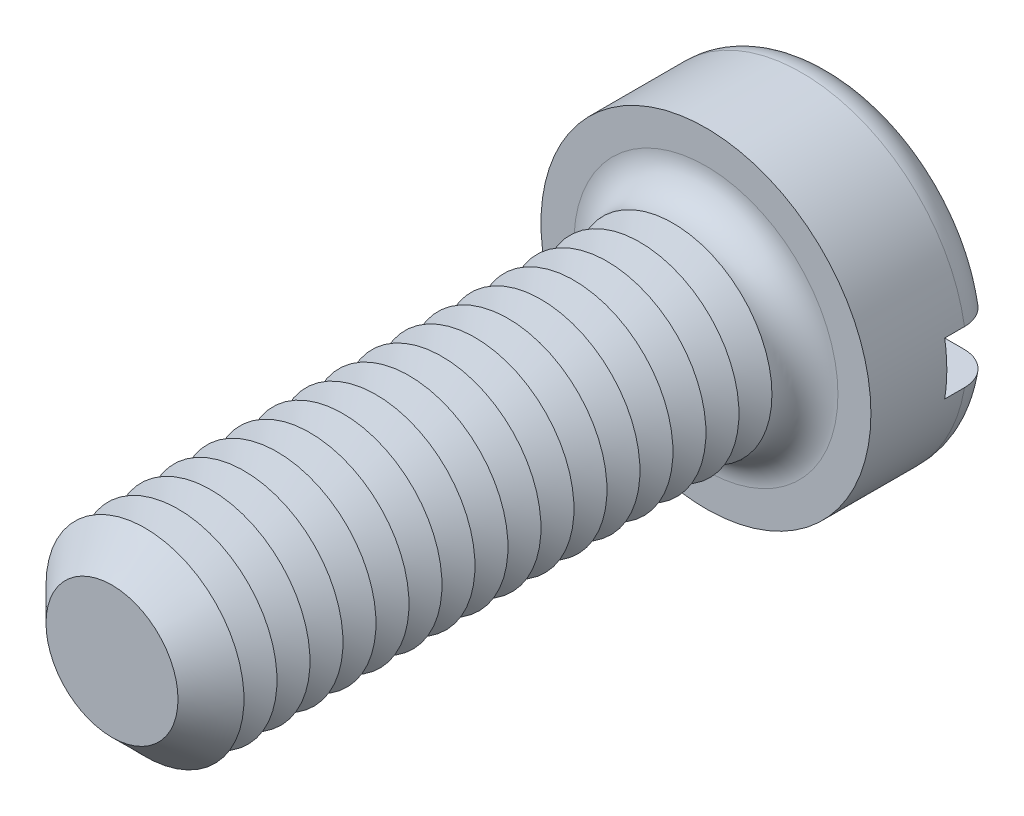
SolidWorks part; units mm, degrees
ref_plane "Front Plane" through (0, 0, 0) normal (0, 0, 1) x (1, 0, 0)
ref_plane "Top Plane" through (0, 0, 0) normal (0, 1, 0) x (1, 0, 0)
ref_plane "Right Plane" through (0, 0, 0) normal (1, 0, 0) x (0, 0, -1)
sketch "Sketch3" plane through (0, 0, 0) normal (0, 0, 1) x (1, 0, 0)
  circle A0 centre (0, 0) radius 5
  dimension "D1" = 10
extrude "Boss-Extrude2" add sketch "Sketch3" against normal blind 3.9
sketch "Sketch4" plane through (0, 0, 0) normal (0, 0, 1) x (1, 0, 0)
  circle A0 centre (0, 0) radius 3
  dimension "D1" = 6
extrude "Boss-Extrude3" add sketch "Sketch4" along normal blind 18
fillet "Fillet1" radius 1 2 edges at (5, 0, -3.9) (3, 0, 0)
chamfer "Chamfer1" distance 1 angle 45 1 edges at (3, 0, 18)
sketch "Sketch5" plane through (0, 0, 0) normal (1, 0, 0) x (0, 0, -1)
  line L0 (1.6944, 0) -> (-7.6738, 0) construction
sketch "Sketch6" plane through (0, 0, 0) normal (1, 0, 0) x (0, 0, -1)
  line L0 (-1, 3) -> (-1.5, 2.134)
  line L1 (-1.5, 2.134) -> (-2, 3)
  line L2 (-1, 3) -> (-17, 3) construction
  line L3 (-2, 3) -> (-1, 3)
  dimension "D1" = 1
revolve "Cut-Revolve1" cut sketch "Sketch6" angle 360 about L0
pattern_linear "LPattern1" count 16 spacing 1 along (0, 0, 1) of "Cut-Revolve1"
sketch "Sketch8" plane through (0, 0, -3.9) normal (0, 0, -1) x (-1, 0, 0)
  line L1 (5, -0.8) -> (-5, -0.8)
  line L2 (5, -0.8) -> (5, 0.8)
  line L3 (5, 0.8) -> (-5, 0.8)
  line L4 (-5, -0.8) -> (-5, 0.8)
  line L5 (5, -0.8) -> (-5, 0.8) construction
  line L6 (5, 0.8) -> (-5, -0.8) construction
  point P0 (0, 0)
  dimension "D1" = 10
  dimension "D2" = 1.6
extrude "Cut-Extrude1" cut sketch "Sketch8" against normal blind 1.6
